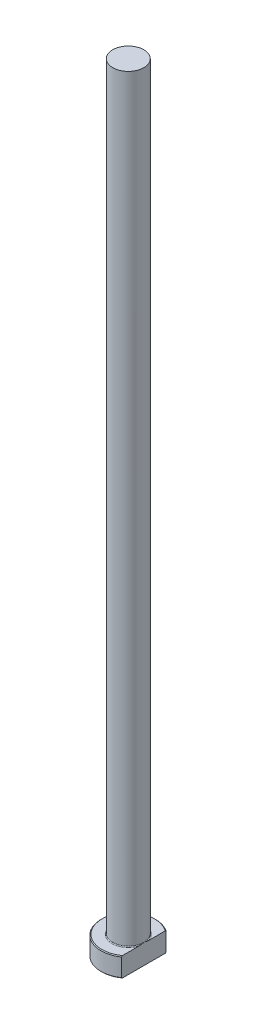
SolidWorks part; units mm, degrees
ref_plane "Front Plane" through (0, 0, 0) normal (0, 0, 1) x (1, 0, 0)
ref_plane "Top Plane" through (0, 0, 0) normal (0, 1, 0) x (1, 0, 0)
ref_plane "Right Plane" through (0, 0, 0) normal (1, 0, 0) x (0, 0, -1)
sketch "Sketch1" plane through (0, 0, 0) normal (0, 0, 1) x (1, 0, 0)
  line L0 (0, 259.9588) -> (0, -15.1925) construction
  line L1 (0, 0) -> (-7, 0)
  line L2 (-7, 0) -> (-7, 5)
  line L3 (-7, 5) -> (-4, 5)
  line L4 (-4, 5) -> (-4, 200)
  line L5 (-4, 200) -> (0, 200)
  line L6 (0, 200) -> (0, 0)
  dimension "L" = 200
  dimension "H" = 14
  dimension "T" = 5
  dimension "D" = 8
revolve "Revolve1" add sketch "Sketch1" angle 360 about L0
chamfer "Chamfer1" distance 0.2 angle 45 2 edges at (0, 5, 7) (0, 0, 7)
fillet "Fillet1" radius 0.2 1 edges at (0, 5, 4)
sketch "Sketch2" plane through (0, 0, 0) normal (0, 1, 0) x (1, 0, 0)
  line L0 (4, 5.7446) -> (4, -5.7446)
  circle A0 centre (0, 0) radius 7 construction
  arc A1 (4, -5.7446) -> (4, 5.7446) centre (0, 0) ccw
  circle A2 centre (0, 0) radius 4 construction
extrude "KEY" cut sketch "Sketch2" along normal through all
